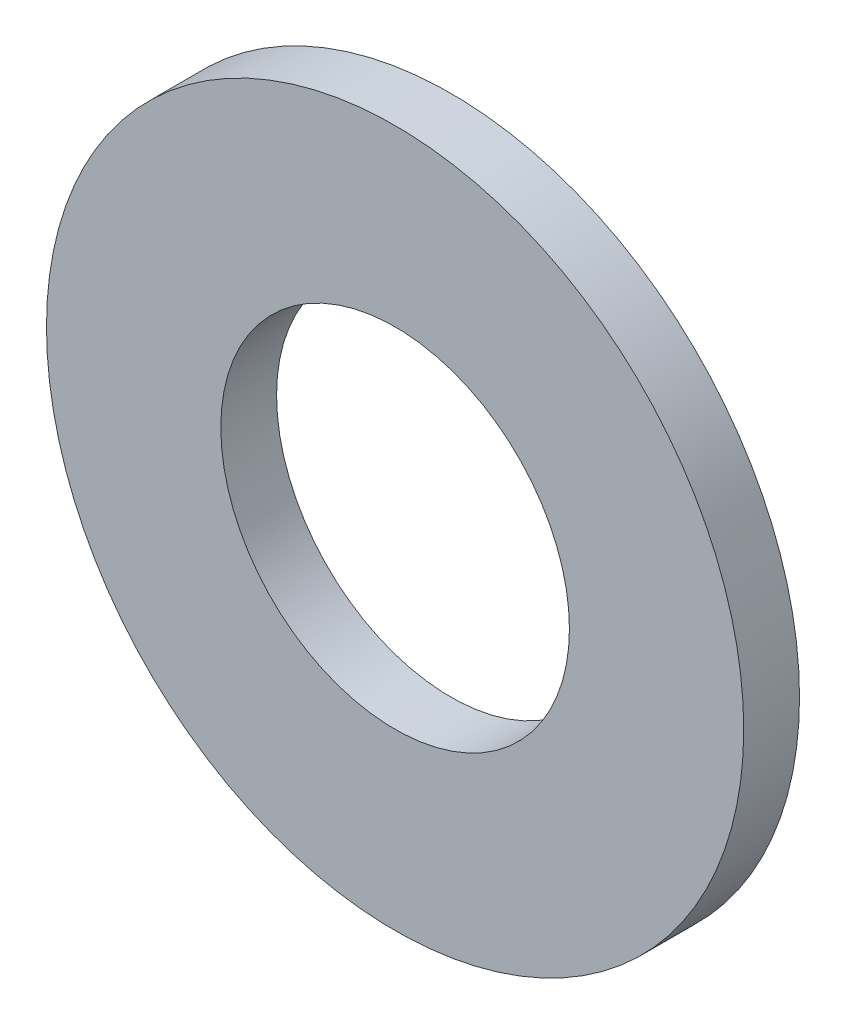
SolidWorks part; units mm, degrees
ref_plane "Face" through (0, 0, 0) normal (0, 0, 1) x (1, 0, 0)
ref_plane "Dessus" through (0, 0, 0) normal (0, 1, 0) x (1, 0, 0)
ref_plane "Droite" through (0, 0, 0) normal (1, 0, 0) x (0, 0, -1)
ref_plane "Plan4" through (0, 0, -0.8) normal (0, 0, -1) x (-1, 0, 0)
sketch "Esquisse1" plane through (0, 0, -0.8) normal (0, 0, -1) x (-1, 0, 0)
  circle A0 centre (0, 0) radius 2.5
  circle A1 centre (0, 0) radius 5
extrude "Base-Extrusion" add sketch "Esquisse1" against normal blind 0.8
